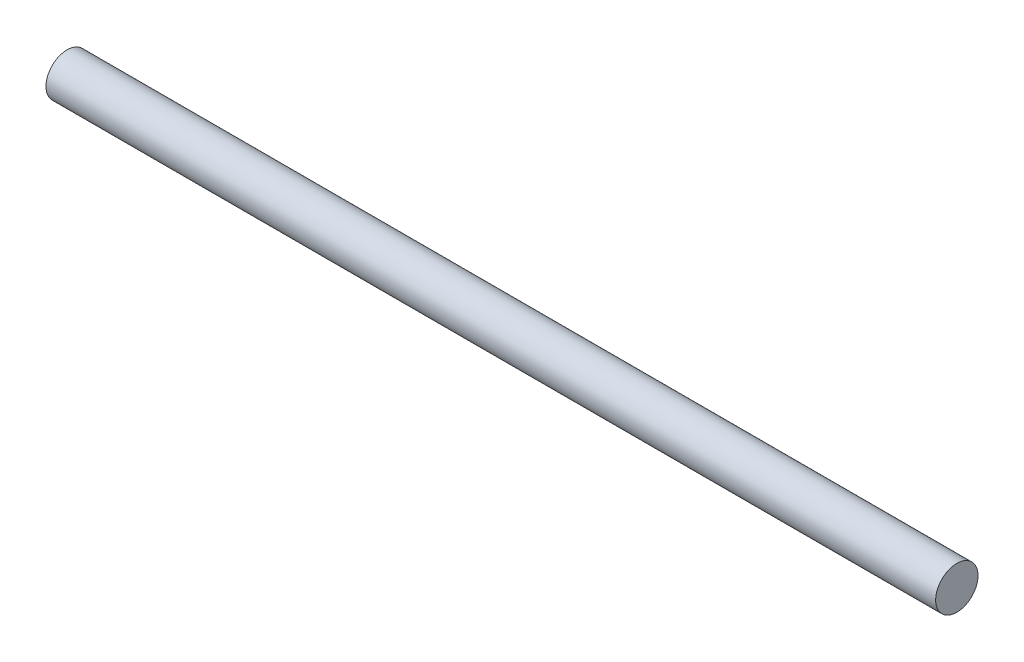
SolidWorks part; units mm, degrees
ref_plane "Front Plane" through (0, 0, 0) normal (0, 0, 1) x (1, 0, 0)
ref_plane "Top Plane" through (0, 0, 0) normal (0, 1, 0) x (1, 0, 0)
ref_plane "Right Plane" through (0, 0, 0) normal (1, 0, 0) x (0, 0, -1)
sketch "Sketch1" plane through (0, 0, 0) normal (1, 0, 0) x (0, 0, -1)
  circle A0 centre (0, 0) radius 9.525
  dimension "D1" = 19.05
extrude "Boss-Extrude1" add sketch "Sketch1" along normal blind 400
